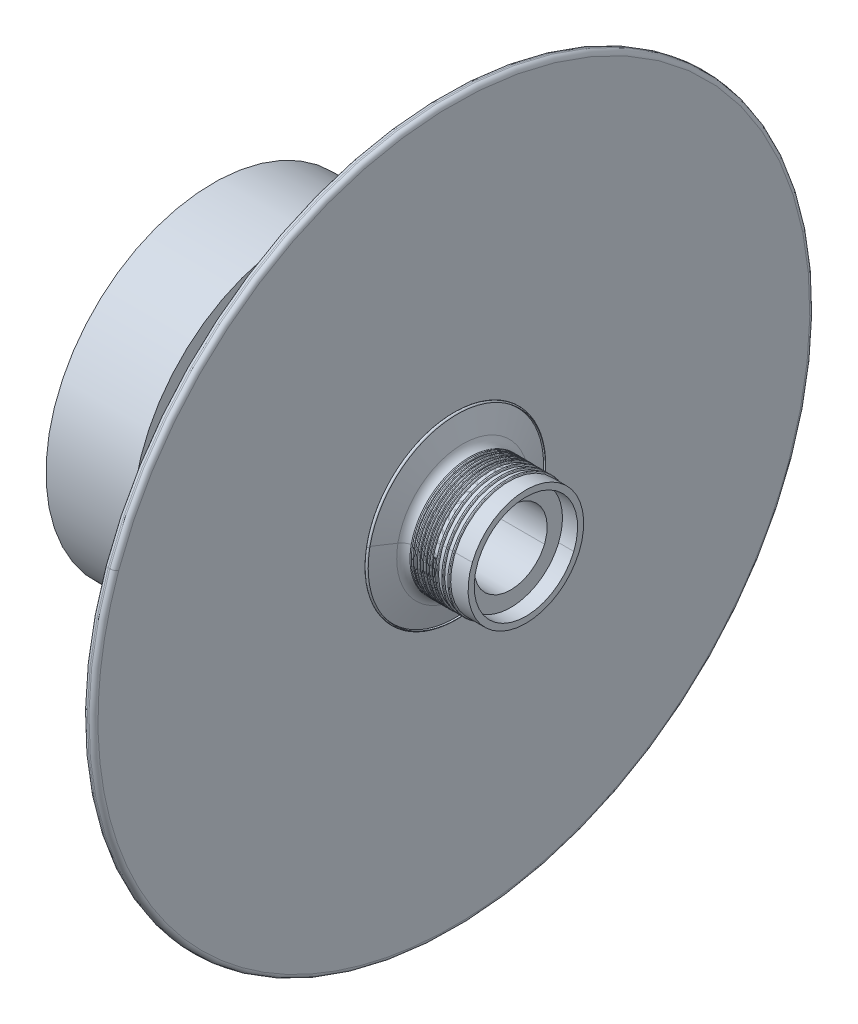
SolidWorks part; units mm, degrees
ref_plane "Alzado" through (0, 0, 0) normal (0, 0, 1) x (1, 0, 0)
ref_plane "Planta" through (0, 0, 0) normal (0, 1, 0) x (1, 0, 0)
ref_plane "Vista lateral" through (0, 0, 0) normal (1, 0, 0) x (0, 0, -1)
imported_body "A1223 (1).IGS<1>"
delete or keep bodies "Sólido-Eliminar/Conservar 1" type delete bodies bodies 101
ref_plane "Plano1" through (19.52, 0, 0) normal (1, 0, 0) x (0, 0, -1)
sketch "Croquis2" plane through (19.52, 0, 0) normal (1, 0, 0) x (0, 0, -1)
  circle A0 centre (13.6251, -11.4202) radius 54.991
  dimension "D1" = 109.982
extrude "Saliente-Extruir1" add sketch "Croquis2" against normal blind 28.3972
